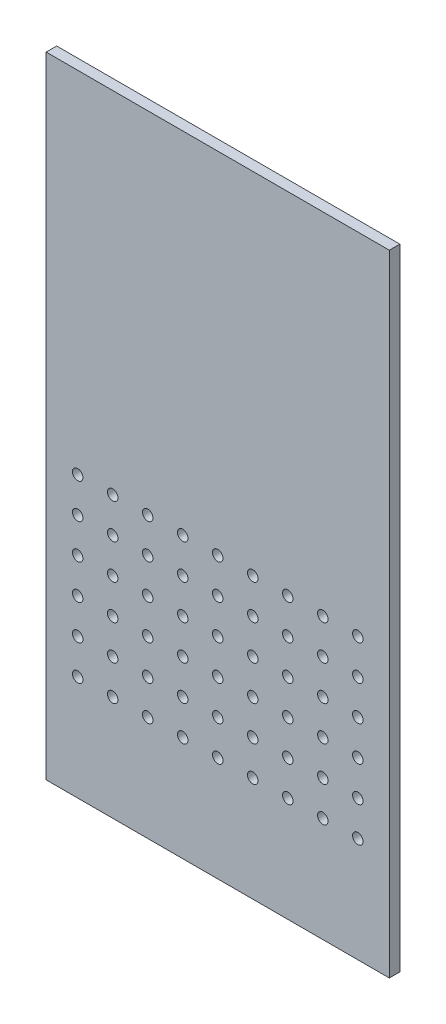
SolidWorks part; units mm, degrees
ref_plane "Alzado" through (0, 0, 0) normal (0, 0, 1) x (1, 0, 0)
ref_plane "Planta" through (0, 0, 0) normal (0, 1, 0) x (1, 0, 0)
ref_plane "Vista lateral" through (0, 0, 0) normal (1, 0, 0) x (0, 0, -1)
sketch "Croquis1" plane through (0, 0, 0) normal (0, 0, 1) x (1, 0, 0)
  line L1 (-44.4487, 105.5332) -> (53.5513, 105.5332)
  line L2 (-44.4487, 105.5332) -> (-44.4487, -74.4668)
  line L3 (-44.4487, -74.4668) -> (53.5513, -74.4668)
  line L4 (53.5513, 105.5332) -> (53.5513, -74.4668)
  circle A0 centre (-35.4487, -24.4668) radius 1.5
  circle A1 centre (-25.4487, -24.4668) radius 1.5
  circle A2 centre (-15.4487, -24.4668) radius 1.5
  circle A3 centre (-5.4487, -24.4668) radius 1.5
  circle A4 centre (4.5513, -24.4668) radius 1.5
  circle A5 centre (14.5513, -24.4668) radius 1.5
  circle A6 centre (24.5513, -24.4668) radius 1.5
  circle A7 centre (34.5513, -24.4668) radius 1.5
  circle A8 centre (44.5513, -24.4668) radius 1.5
  circle A9 centre (-25.4487, -34.4668) radius 1.5
  circle A10 centre (-15.4487, -34.4668) radius 1.5
  circle A11 centre (-5.4487, -34.4668) radius 1.5
  circle A12 centre (4.5513, -34.4668) radius 1.5
  circle A13 centre (14.5513, -34.4668) radius 1.5
  circle A14 centre (24.5513, -34.4668) radius 1.5
  circle A15 centre (34.5513, -34.4668) radius 1.5
  circle A16 centre (44.5513, -34.4668) radius 1.5
  circle A17 centre (-25.4487, -44.4668) radius 1.5
  circle A18 centre (-15.4487, -44.4668) radius 1.5
  circle A19 centre (-5.4487, -44.4668) radius 1.5
  circle A20 centre (4.5513, -44.4668) radius 1.5
  circle A21 centre (14.5513, -44.4668) radius 1.5
  circle A22 centre (24.5513, -44.4668) radius 1.5
  circle A23 centre (34.5513, -44.4668) radius 1.5
  circle A24 centre (44.5513, -44.4668) radius 1.5
  circle A25 centre (-35.4487, -14.4668) radius 1.5
  circle A26 centre (-25.4487, -14.4668) radius 1.5
  circle A27 centre (-15.4487, -14.4668) radius 1.5
  circle A28 centre (-5.4487, -14.4668) radius 1.5
  circle A29 centre (4.5513, -14.4668) radius 1.5
  circle A30 centre (14.5513, -14.4668) radius 1.5
  circle A31 centre (24.5513, -14.4668) radius 1.5
  circle A32 centre (34.5513, -14.4668) radius 1.5
  circle A33 centre (44.5513, -14.4668) radius 1.5
  circle A34 centre (-25.4487, -4.4668) radius 1.5
  circle A35 centre (-15.4487, -4.4668) radius 1.5
  circle A36 centre (-5.4487, -4.4668) radius 1.5
  circle A37 centre (4.5513, -4.4668) radius 1.5
  circle A38 centre (14.5513, -4.4668) radius 1.5
  circle A39 centre (24.5513, -4.4668) radius 1.5
  circle A40 centre (34.5513, -4.4668) radius 1.5
  circle A41 centre (-35.4487, -34.4668) radius 1.5
  circle A42 centre (-35.4487, -44.4668) radius 1.5
  circle A43 centre (44.5513, -4.4668) radius 1.5
  circle A44 centre (-25.4487, 5.5332) radius 1.5
  circle A45 centre (-25.4487, -54.4668) radius 1.5
  circle A46 centre (-15.4487, -54.4668) radius 1.5
  circle A47 centre (-5.4487, -54.4668) radius 1.5
  circle A48 centre (4.5513, -54.4668) radius 1.5
  circle A49 centre (14.5513, -54.4668) radius 1.5
  circle A50 centre (24.5513, -54.4668) radius 1.5
  circle A51 centre (34.5513, -54.4668) radius 1.5
  circle A52 centre (44.5513, -54.4668) radius 1.5
  circle A53 centre (-25.4487, -64.4668) radius 1.5
  circle A54 centre (-15.4487, -64.4668) radius 1.5
  circle A55 centre (-5.4487, -64.4668) radius 1.5
  circle A56 centre (4.5513, -64.4668) radius 1.5
  circle A57 centre (14.5513, -64.4668) radius 1.5
  circle A58 centre (24.5513, -64.4668) radius 1.5
  circle A59 centre (34.5513, -64.4668) radius 1.5
  circle A60 centre (44.5513, -64.4668) radius 1.5
  circle A61 centre (-35.4487, -54.4668) radius 1.5
  circle A62 centre (-35.4487, -64.4668) radius 1.5
  circle A63 centre (-15.4487, 5.5332) radius 1.5
  circle A64 centre (-5.4487, 5.5332) radius 1.5
  circle A65 centre (4.5513, 5.5332) radius 1.5
  circle A66 centre (14.5513, 5.5332) radius 1.5
  circle A67 centre (24.5513, 5.5332) radius 1.5
  circle A68 centre (34.5513, 5.5332) radius 1.5
  circle A69 centre (44.5513, 5.5332) radius 1.5
  circle A70 centre (-35.4487, -4.4668) radius 1.5
  circle A71 centre (-35.4487, 5.5332) radius 1.5
  dimension "D3" = 2
  dimension "D1" = 98
  dimension "D2" = 180
  dimension "D5" = 50
  dimension "D6" = 9
  dimension "D7" = 5
extrude "Saliente-Extruir1" add sketch "Croquis1" along normal blind 3
